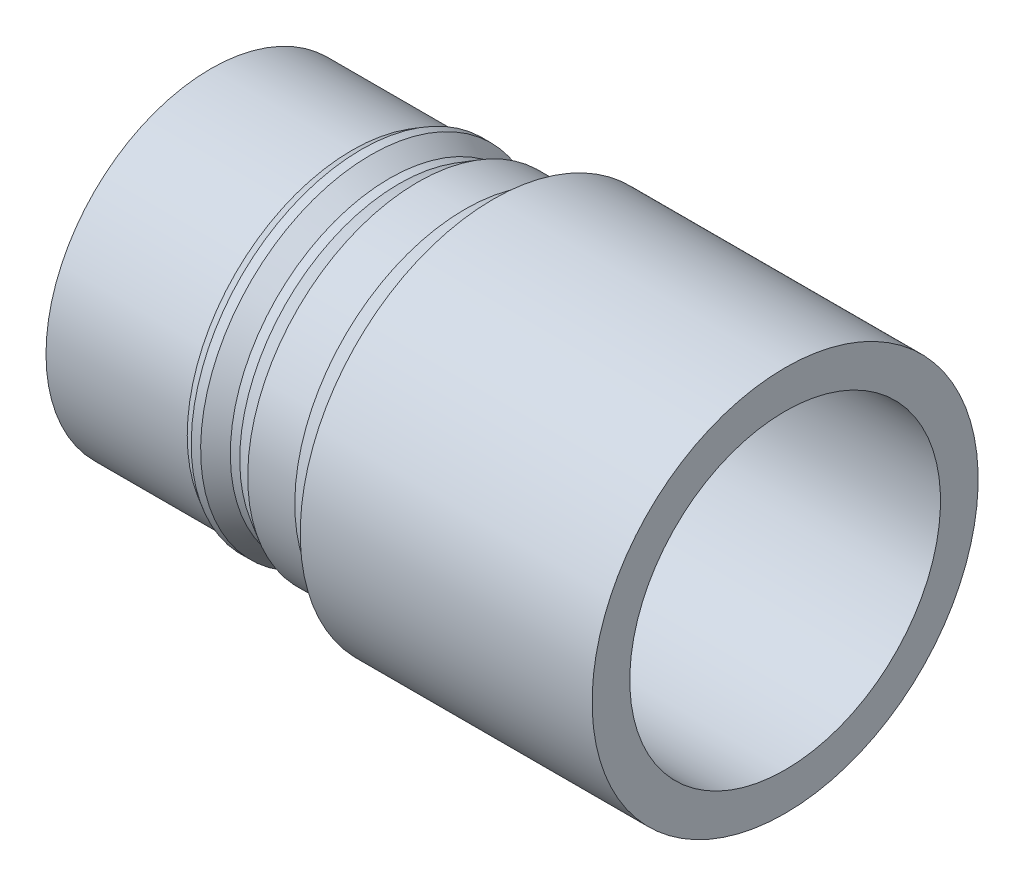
SolidWorks part; units mm, degrees
ref_plane "Alzado" through (0, 0, 0) normal (0, 0, 1) x (1, 0, 0)
ref_plane "Planta" through (0, 0, 0) normal (0, 1, 0) x (1, 0, 0)
ref_plane "Vista lateral" through (0, 0, 0) normal (1, 0, 0) x (0, 0, -1)
sketch "Croquis1" plane through (0, 0, 0) normal (0, 0, 1) x (1, 0, 0)
  line L0 (0, 0) -> (30, 0) construction
  line L1 (0, 0) -> (0, 17.5)
  line L2 (0, 17.5) -> (15, 17.5)
  line L3 (15, 17.5) -> (16, 18.0774)
  line L4 (16, 18.0774) -> (17, 18.0774)
  line L5 (16.5, 18.0774) -> (16.5, 0) construction
  line L6 (18, 17.5) -> (17, 18.0774)
  line L7 (18, 17.5) -> (19, 16.9226)
  line L8 (19, 16.9226) -> (20, 16.9226)
  line L9 (19.5, 16.9226) -> (19.5, 0) construction
  line L10 (21, 17.5) -> (20, 16.9226)
  line L11 (21, 17.5) -> (22, 18.0774)
  line L12 (22, 18.0774) -> (27, 18.0774)
  line L14 (30, 0) -> (0, 0)
  line L17 (30, 19.0774) -> (30, 0)
  line L18 (27, 18.0774) -> (30, 19.0774)
  dimension "D1" = 35
  dimension "D2" = 15
  dimension "D3" = 1
  dimension "D4" = 1
  dimension "D5" = 150
  dimension "D6" = 1
  dimension "D7" = 1
  dimension "D8" = 5
  dimension "D9" = 3
  dimension "D10" = 1
revolve "Revolución1" add sketch "Croquis1" angle 360 about L14
sketch "Croquis2" plane through (30, 0, 0) normal (1, 0, 0) x (0, 0, -1)
  circle A0 centre (0, 0) radius 20.5
  dimension "D1" = 41
extrude "Saliente-Extruir1" add sketch "Croquis2" along normal blind 31
sketch "Croquis3" plane through (61, 0, 0) normal (1, 0, 0) x (0, 0, -1)
  circle A0 centre (0, 0) radius 16.5
  dimension "D1" = 33
extrude "Cortar-Extruir1" cut sketch "Croquis3" against normal through all
